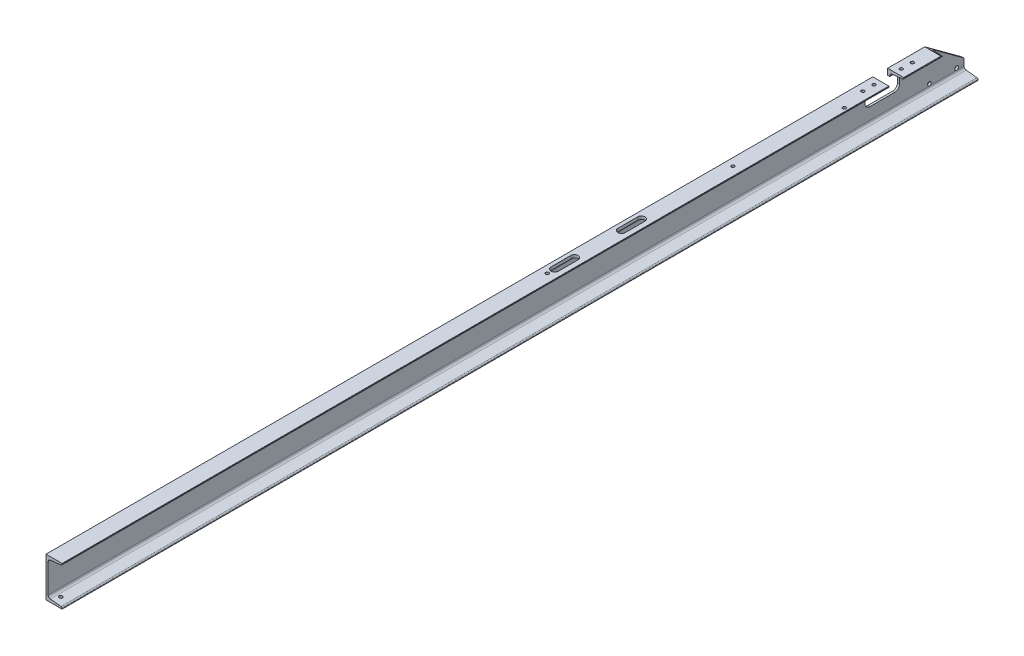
SolidWorks part; units mm, degrees
ref_plane "前视基准面" through (0, 0, 0) normal (0, 0, 1) x (1, 0, 0)
ref_plane "上视基准面" through (0, 0, 0) normal (0, 1, 0) x (1, 0, 0)
ref_plane "右视基准面" through (0, 0, 0) normal (1, 0, 0) x (0, 0, -1)
sketch "草图1" plane through (0, 0, 0) normal (0, 0, 1) x (1, 0, 0)
  line L0 (65, 80) -> (0, 80)
  line L1 (0, 80) -> (0, -80)
  line L2 (0, -80) -> (65, -80)
  line L3 (65, -80) -> (65, -77.4971)
  line L4 (60.528, -72.5251) -> (17.444, -67.9498)
  line L5 (8.5, -58.0057) -> (8.5, 58.0057)
  line L6 (17.444, 67.9498) -> (60.528, 72.5251)
  line L7 (65, 77.4971) -> (65, 80)
  line L8 (36.75, 80) -> (36.75, 70) construction
  line L9 (36.75, -70) -> (36.75, -80) construction
  arc A0 (8.5, 58.0057) -> (17.444, 67.9498) centre (18.5, 58.0057) cw
  arc A1 (17.444, -67.9498) -> (8.5, -58.0057) centre (18.5, -58.0057) cw
  arc A2 (60.528, 72.5251) -> (65, 77.4971) centre (60, 77.4971) ccw
  arc A3 (65, -77.4971) -> (60.528, -72.5251) centre (60, -77.4971) ccw
  point P19 (65, 73)
  point P22 (65, -73)
  dimension "D11" = 10
  dimension "D12" = 5
  dimension "D1" = 160
  dimension "D2" = 7
  dimension "D3" = 7
  dimension "D4" = 80
  dimension "D5" = 65
  dimension "D6" = 65
  dimension "D7" = 8.5
  dimension "D8" = 28.25
  dimension "D9" = 10
  dimension "D10" = 10
extrude "拉伸1" add sketch "草图1" along normal mid plane 3700
sketch "草图2" plane through (0, 0, 0) normal (-1, 0, 0) x (0, 0, 1)
  line L0 (-1850, 80) -> (-1850, -30)
  line L1 (-1850, -30) -> (-1700, 80)
  line L2 (1850, 80) -> (-1850, 80) construction
  line L3 (-1700, 80) -> (-1850, 80)
  line L4 (-875.6288, -50) -> (-683.7096, -50) construction
  line L5 (-1550, 80) -> (-1550, 55)
  line L6 (-1550, 55) -> (-1570, 55)
  line L7 (-1590, 35) -> (-1590, 10)
  line L8 (-1570, -10) -> (-1470, -10)
  line L9 (-1450, 10) -> (-1450, 35)
  line L10 (-1470, 55) -> (-1490, 55)
  line L11 (-1490, 55) -> (-1490, 80)
  line L12 (-1490, 80) -> (-1550, 80)
  line L13 (-1850, 80) -> (-1850, -80) construction
  line L14 (1850, -80) -> (-1850, -80) construction
  circle A0 centre (-1820, -50) radius 7.5
  circle A1 centre (-1710, -50) radius 7.5
  circle A2 centre (-1617, 40) radius 6.5
  circle A3 centre (-1417, 40) radius 6.5
  circle A4 centre (-1710, 50) radius 7.5
  arc A5 (-1450, 35) -> (-1470, 55) centre (-1470, 35) ccw
  arc A6 (-1470, -10) -> (-1450, 10) centre (-1470, 10) ccw
  arc A7 (-1590, 10) -> (-1570, -10) centre (-1570, 10) ccw
  arc A8 (-1570, 55) -> (-1590, 35) centre (-1570, 35) ccw
  point P32 (-1450, 55)
  point P35 (-1450, -10)
  dimension "D3" = 110
  dimension "D4" = 15
  dimension "D5" = 15
  dimension "D12" = 40
  dimension "D13" = 67
  dimension "D14" = 13
  dimension "D15" = 200
  dimension "D16" = 40
  dimension "D17" = 13
  dimension "D20" = 140
  dimension "D21" = 30
  dimension "D22" = 15
  dimension "D23" = 20
  dimension "D1" = 30
  dimension "D2" = 30
  dimension "D6" = 60
  dimension "D7" = 25
  dimension "D8" = 65
  dimension "D9" = 300
  dimension "D10" = 140
  dimension "D11" = 40
  dimension "D18" = 150
  dimension "D19" = 50
extrude "切除-拉伸1" cut sketch "草图2" against normal through all
sketch "草图3" plane through (0, 80, 0) normal (0, 1, 0) x (-1, 0, 0)
  line L0 (-30, 150.1602) -> (-30, -948.4503) construction
  line L1 (0, -1550) -> (0, -1700) construction
  line L2 (-60.528, -1850) -> (-17.444, -1850) construction
  circle A0 centre (-30, -1620) radius 6.5
  circle A1 centre (-30, -1575) radius 6.5
  circle A2 centre (-30, -1465) radius 6.5
  circle A3 centre (-30, -1420) radius 6.5
  circle A4 centre (-30, -895) radius 6.5
  circle A5 centre (-30, -145) radius 6.5
  dimension "D2" = 230
  dimension "D3" = 45
  dimension "D4" = 110
  dimension "D5" = 45
  dimension "D6" = 955
  dimension "D7" = 750
  dimension "D8" = 13
  dimension "D9" = 13
  dimension "D10" = 13
  dimension "D11" = 13
  dimension "D12" = 13
  dimension "D13" = 13
  dimension "D1" = 30
extrude "切除-拉伸2" cut sketch "草图3" against normal blind 20
sketch "草图4" plane through (0, 0, 0) normal (-1, 0, 0) x (0, 0, 1)
  line L0 (1850, 80) -> (-1490, 80) construction
  line L1 (-1850, -30) -> (-1850, -80) construction
  circle A0 centre (-920, 29) radius 6.5
  dimension "D1" = 51
  dimension "D3" = 13
  dimension "D2" = 930
extrude "切除-拉伸3" cut sketch "草图4" against normal blind 20
pattern_linear "阵列(线性)1" count 10 spacing 200 along (0, 0, 1) of "切除-拉伸3"
sketch "草图5" plane through (0, 80, 0) normal (0, 1, 0) x (-1, 0, 0)
  line L0 (-65, 1850) -> (-65, -1490) construction
  line L1 (-30, -895) -> (-30, -189.2908) construction
  line L2 (-45, -445) -> (-45, -525)
  line L3 (-15, -445) -> (-15, -525)
  line L4 (-45, -175) -> (-45, -255)
  line L5 (-15, -175) -> (-15, -255)
  circle A0 centre (-51, -1324) radius 6.5
  circle A1 centre (-30, -1420) radius 6.5 construction
  arc A2 (-45, -525) -> (-15, -525) centre (-30, -525) ccw
  arc A3 (-15, -445) -> (-45, -445) centre (-30, -445) ccw
  circle A4 centre (-30, -895) radius 6.5 construction
  arc A5 (-45, -255) -> (-15, -255) centre (-30, -255) ccw
  arc A6 (-15, -175) -> (-45, -175) centre (-30, -175) ccw
  dimension "D1" = 13
  dimension "D2" = 14
  dimension "D3" = 96
  dimension "D4" = 30
  dimension "D5" = 30
  dimension "D6" = 370
  dimension "D7" = 80
  dimension "D8" = 30
  dimension "D9" = 30
  dimension "D10" = 190
  dimension "D11" = 80
extrude "切除-拉伸4" cut sketch "草图5" against normal blind 15
sketch "草图6" plane through (0, -80, 0) normal (0, -1, 0) x (1, 0, 0)
  line L0 (0, 1850) -> (0, -1850) construction
  line L1 (0, 1850) -> (65, 1850) construction
  circle A0 centre (30, 1820) radius 6.5
  dimension "D1" = 30
  dimension "D2" = 30
  dimension "D3" = 13
extrude "切除-拉伸5" cut sketch "草图6" against normal blind 20
